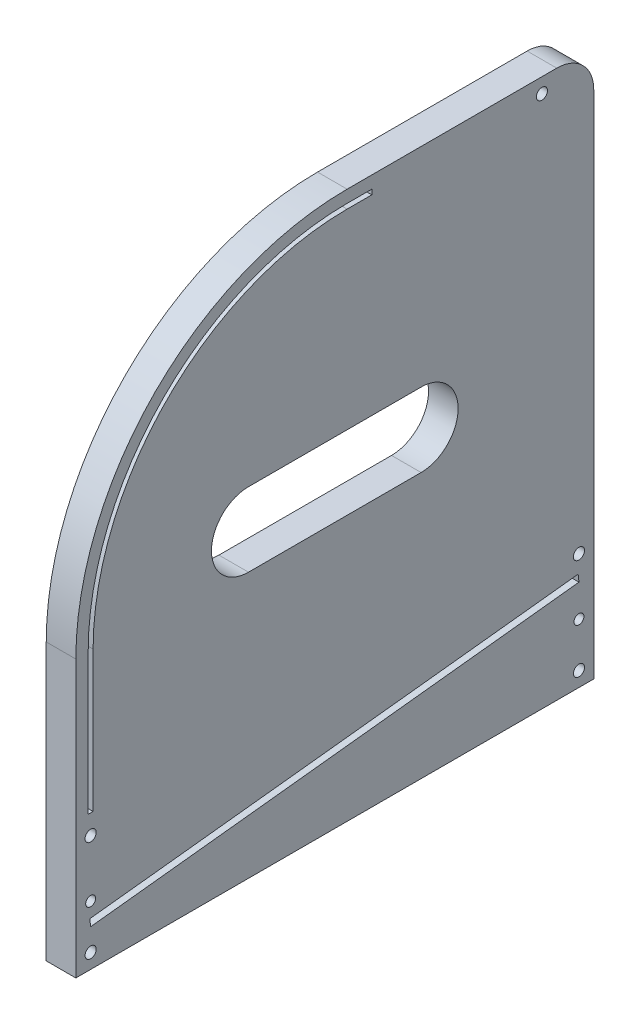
SolidWorks part; units mm, degrees
ref_plane "Front Plane" through (0, 0, 0) normal (0, 0, 1) x (1, 0, 0)
ref_plane "Top Plane" through (0, 0, 0) normal (0, 1, 0) x (1, 0, 0)
ref_plane "Right Plane" through (0, 0, 0) normal (1, 0, 0) x (0, 0, -1)
body saved out of another part "Stock-Donut Shop-1"
hole_wizard "CBORE for M4 Pan Head Machine Screw" positions "3DSketch1" profile "Sketch1" counterbore size "M4" standard "ANSI Metric"
sketch3d "3DSketch1"
  point P0 (-240, 216, -84)
  point P3 (-240, 47, -99)
  point P6 (-240, 6, -99)
  point P9 (-240, 47, 99)
  point P12 (-240, 6, 99)
sketch "Sketch1" plane through (-240, 216, -84) normal (0, 1, 0) x (0, 0, 1)
  line L0 (0, 0) -> (0, 30)
  line L1 (0, 30) -> (2.25, 28.6481)
  line L2 (2.25, 28.6481) -> (2.25, 3.1)
  line L3 (2.25, 3.1) -> (4.5, 3.1)
  line L4 (4.5, 3.1) -> (4.5, 0)
  line L5 (4.5, 0) -> (0, 0)
  line L6 (0, 30) -> (-2.25, 28.6481) construction
  line L7 (0, -6.35) -> (0, 107.95) construction
  dimension "Hole Dia." = 4.5
  dimension "Hole Depth" = 30
  dimension "C'Bore Dia." = 9
  dimension "C'Bore Depth" = 3.1
  dimension "Drill Angle" = 118
hole_wizard "Ø4.0mm Dowel Hole1" positions "3DSketch2" profile "Sketch2" hole size "Ø4.0" standard "ANSI Metric"
sketch3d "3DSketch2"
  point P0 (-228, 24, -99)
  point P3 (-228, 24, 99)
sketch "Sketch2" plane through (-228, 24, -99) normal (0, 1, 0) x (0, 0, -1)
  line L0 (0, 0) -> (0, 6)
  line L1 (0, 6) -> (2, 6)
  line L2 (2, 6) -> (2, 0)
  line L3 (2, 0) -> (0, 0)
  line L4 (0, 6) -> (-2, 6) construction
  line L5 (0, -6.35) -> (0, 107.95) construction
  dimension "Hole Dia." = 4
  dimension "Hole Depth" = 6
  dimension "Drill Angle" = 180
hole_wizard "Ø4.0mm Dowel Hole2" positions "3DSketch3" profile "Sketch3" hole size "Ø4.0" standard "ANSI Metric"
sketch3d "3DSketch3"
  point P0 (-228, 24, -99)
  point P3 (-228, 24, 99)
sketch "Sketch3" plane through (-228, 24, -99) normal (0, 1, 0) x (0, 0, 1)
  line L0 (0, 0) -> (0, 14)
  line L1 (0, 14) -> (2, 14)
  line L2 (2, 14) -> (2, 0)
  line L3 (2, 0) -> (0, 0)
  line L4 (0, 14) -> (-2, 14) construction
  line L5 (0, -6.35) -> (0, 107.95) construction
  dimension "Hole Dia." = 4
  dimension "Hole Depth" = 14
  dimension "Drill Angle" = 180
